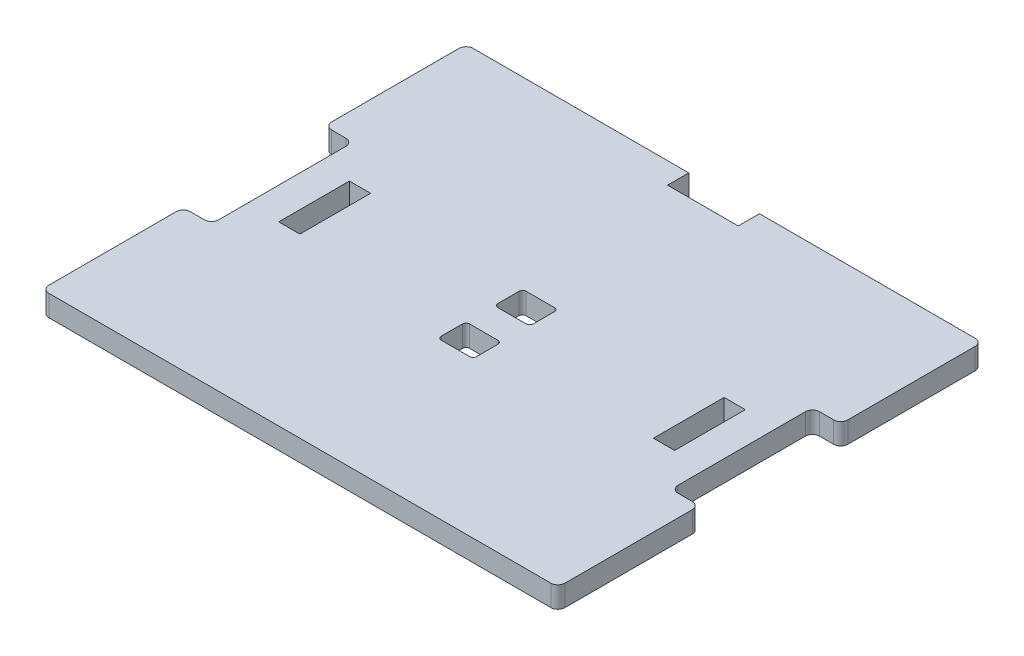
SolidWorks part; units mm, degrees
ref_plane "Front Plane" through (0, 0, 0) normal (0, 0, 1) x (1, 0, 0)
ref_plane "Top Plane" through (0, 0, 0) normal (0, 1, 0) x (1, 0, 0)
ref_plane "Right Plane" through (0, 0, 0) normal (1, 0, 0) x (0, 0, -1)
sketch "Sketch1" plane through (0, 0, 0) normal (0, 1, 0) x (1, 0, 0)
  line L0 (-65, 20) -> (-65, -20)
  line L1 (-65, 20) -> (-73, 20)
  line L2 (-73, 20) -> (-73, 60)
  line L3 (-73, 60) -> (73, 60)
  line L4 (0, 0) -> (0, 60) construction
  line L5 (0, 0) -> (-65, 0) construction
  line L6 (-65, -20) -> (-73, -20)
  line L7 (-73, -20) -> (-73, -60)
  line L8 (-73, -60) -> (73, -60)
  line L9 (-73, 60) -> (73, 60)
  line L10 (-73, 20) -> (-73, 60)
  line L11 (-65, 20) -> (-73, 20)
  line L12 (-73, -60) -> (73, -60)
  line L13 (-73, -20) -> (-73, -60)
  line L14 (-65, -20) -> (-73, -20)
  line L15 (-65, -20) -> (-73, -20)
  line L16 (-65, -20) -> (-73, -20)
  line L17 (-73, -20) -> (-73, -60)
  line L18 (-73, -60) -> (73, -60)
  line L19 (-73, -60) -> (73, -60)
  line L20 (-73, -20) -> (-73, -60)
  line L21 (-65, 20) -> (-73, 20)
  line L22 (-73, 20) -> (-73, 60)
  line L23 (-73, 60) -> (73, 60)
  line L24 (-73, 60) -> (73, 60)
  line L25 (-73, 20) -> (-73, 60)
  line L26 (-65, 20) -> (-73, 20)
  line L27 (65, 20) -> (73, 20)
  line L28 (73, 20) -> (73, 60)
  line L29 (73, 20) -> (73, 60)
  line L30 (65, 20) -> (73, 20)
  line L31 (73, -20) -> (73, -60)
  line L32 (73, -20) -> (73, -60)
  line L33 (65, -20) -> (73, -20)
  line L34 (65, -20) -> (73, -20)
  line L35 (65, -20) -> (73, -20)
  line L36 (73, -20) -> (73, -60)
  line L37 (65, 20) -> (73, 20)
  line L38 (73, 20) -> (73, 60)
  line L39 (73, -20) -> (73, -60)
  line L40 (65, -20) -> (73, -20)
  line L41 (73, 20) -> (73, 60)
  line L42 (65, 20) -> (73, 20)
  line L43 (65, 20) -> (65, -20)
  line L44 (-73, -60) -> (73, -60)
  point P2 (-65, 0)
  point P19 (0, -60)
  dimension "D1" = 65
  dimension "D2" = 40
  dimension "D3" = 8
  dimension "D4" = 120
extrude "Boss-Extrude1" add sketch "Sketch1" along normal blind 6 contours L43 L27 L28 L3 L2 L1 L0 L6 L7 L8 L31 L33
fillet "Fillet1" radius 2 12 edges at (-73, 3, -20) (-65, 3, -20) (-73, 3, -60) (-73, 3, 20) (-65, 3, 20) (-73, 3, 60) (73, 3, 60) (73, 3, -60) (73, 3, -20) (73, 3, 20) (65, 3, 20) (65, 3, -20)
sketch "Sketch2" plane through (0, 6, 0) normal (0, 1, 0) x (1, 0, 0)
  line L0 (0, 0) -> (0, 60) construction
  line L1 (50, 10) -> (56, 10)
  line L2 (50, 10) -> (50, -10)
  line L3 (50, -10) -> (56, -10)
  line L4 (56, 10) -> (56, -10)
  line L5 (-71, 60) -> (71, 60) construction
  line L6 (-50, -10) -> (-56, -10)
  line L7 (-56, 10) -> (-56, -10)
  line L8 (-50, 10) -> (-56, 10)
  line L9 (-50, 10) -> (-50, -10)
  point P9 (50, 0)
  dimension "D1" = 20
  dimension "D2" = 6
  dimension "D3" = 50
extrude "Cut-Extrude1" cut sketch "Sketch2" against normal through all and the other way through all
sketch "Sketch3" plane through (0, 6, 0) normal (0, 1, 0) x (1, 0, 0)
  line L1 (-5, 8) -> (5, 8)
  line L2 (-5, 8) -> (-5, 0)
  line L3 (-5, 0) -> (5, 0)
  line L4 (5, 8) -> (5, 0)
  line L7 (-5, -8) -> (5, -8)
  line L8 (-5, -8) -> (-5, -16)
  line L9 (-5, -16) -> (5, -16)
  line L10 (5, -8) -> (5, -16)
  point P0 (0, 0)
  point P11 (0, -8)
  point P13 (0, 0)
  dimension "D1" = 10
  dimension "D2" = 8
  dimension "D3" = 8
extrude "Cut-Extrude2" cut sketch "Sketch3" against normal through all
fillet "Fillet2" radius 1 8 edges at (5, 3, 8) (5, 3, -8) (5, 3, 16) (5, 3, 0) (-5, 3, 16) (-5, 3, 0) (-5, 3, 8) (-5, 3, -8)
sketch "Sketch4" plane through (0, 6, 0) normal (0, 1, 0) x (1, 0, 0)
  line L0 (0, 60) -> (0, 0) construction
  line L1 (-71, 60) -> (71, 60) construction
  line L3 (-10, 60) -> (10, 60)
  line L4 (-10, 60) -> (-10, 54)
  line L5 (-10, 54) -> (10, 54)
  line L6 (10, 60) -> (10, 54)
  point P9 (0, 60)
  dimension "D1" = 6
  dimension "D2" = 20
extrude "Cut-Extrude3" cut sketch "Sketch4" against normal through all
